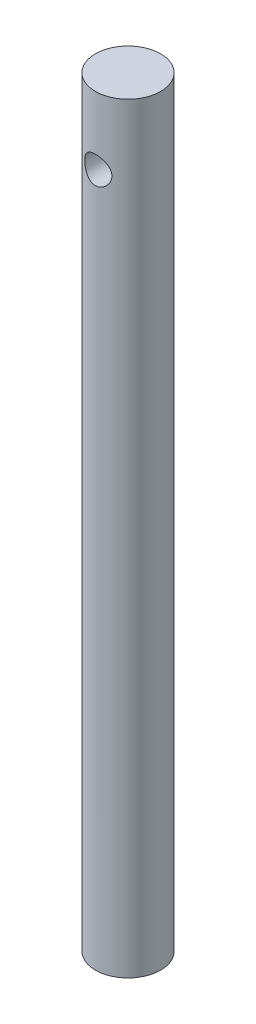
SolidWorks part; units mm, degrees
ref_plane "Front Plane" through (0, 0, 0) normal (0, 0, 1) x (1, 0, 0)
ref_plane "Top Plane" through (0, 0, 0) normal (0, 1, 0) x (1, 0, 0)
ref_plane "Right Plane" through (0, 0, 0) normal (1, 0, 0) x (0, 0, -1)
sketch "Sketch1" plane through (0, 0, 0) normal (0, 0, 1) x (1, 0, 0)
  line L0 (0, 0) -> (0, 140)
  line L1 (0, 140) -> (-6, 140)
  line L2 (-6, 140) -> (-6, 0)
  line L3 (-6, 0) -> (0, 0)
revolve "Revolve1" add sketch "Sketch1" angle 360 about L0
sketch "Sketch2" plane through (0, 0, 0) normal (0, 0, 1) x (1, 0, 0)
  line L0 (-6, 0) -> (6, 0) construction
  line L1 (0, -1000) -> (0, 49000) construction
  circle A0 centre (0, 20) radius 5
  dimension "D1" = 10
  dimension "D2" = 20
sketch "Sketch4" plane through (0, 0, 0) normal (0, 0, 1) x (1, 0, 0)
  line L0 (6, 140) -> (-6, 140) construction
  circle A0 centre (0, 127.5) radius 2.5
  dimension "D1" = 5
  dimension "D2" = 12.5
extrude "Cut-Extrude2" cut sketch "Sketch4" against normal through all both and the other way through all
equation "\"ShaftDiameter\"= 12mm"
equation "\"D5@Sketch1\" = \"ShaftDiameter\""
equation "\"PendulumDiameter\"=12mm"
equation "\"PendulumLength\"= 140mm"
equation "\"D1@Sketch1\"=\"PendulumDiameter\"/2"
equation "\"EncoderOuterDiameter\"=1.5"
equation "\"EncoderShaftDiameter\"= 6mm"
equation "\"EncoderShaftLength\"=15mm+.5in+3mm"
equation "\"PendulumHolderangle\"=60"
equation "\"PendulumholderBottomHeight\"= 75"
equation "\"D3@Sketch1\"=\"PendulumholderBottomHeight\""
equation "\"PendulumholderBottomWidth\"= 75"
equation "\"D4@Sketch1\"=\"PendulumholderBottomWidth\""
equation "\"PendulumholderHeight\"=25"
equation "\"BearingOutsideDiameter\"=21mm"
equation "\"D2@Sketch1\"=\"PendulumLength\""
